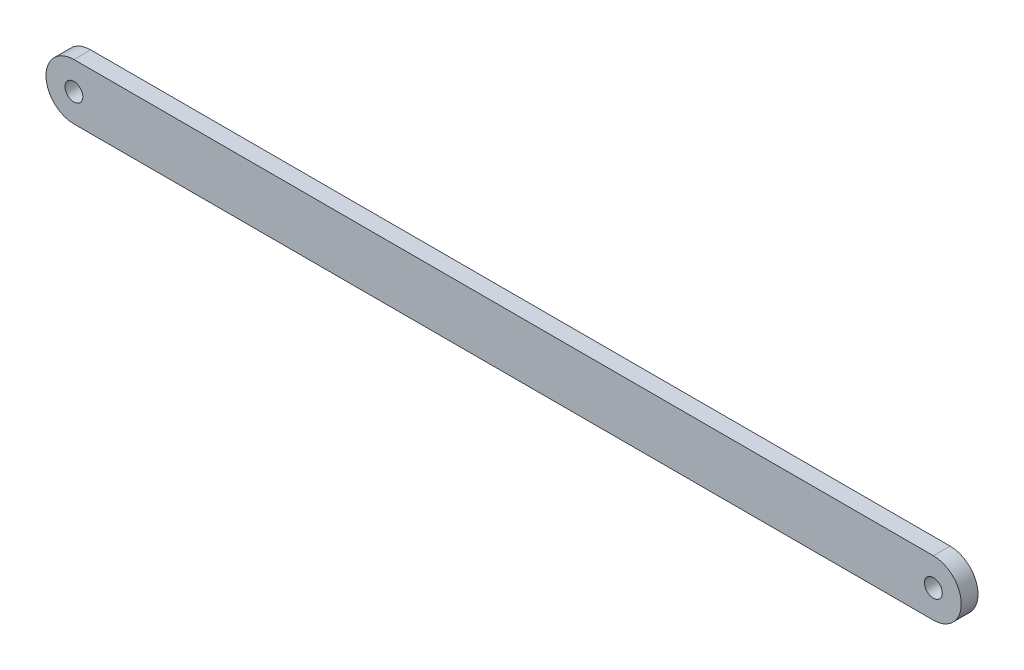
SolidWorks part; units mm, degrees
ref_plane "Plan de face" through (0, 0, 0) normal (0, 0, 1) x (1, 0, 0)
ref_plane "Plan de dessus" through (0, 0, 0) normal (0, 1, 0) x (1, 0, 0)
ref_plane "Plan de droite" through (0, 0, 0) normal (1, 0, 0) x (0, 0, -1)
sketch "Esquisse1" plane through (0, 0, 0) normal (0, 0, 1) x (1, 0, 0)
  line L0 (182.2501, 0) -> (-164.2748, 0) construction
  line L1 (0, -20.5495) -> (0, 63.7295) construction
  line L2 (-140, -20.5495) -> (-140, 96.894) construction
  line L3 (-175.6383, -10) -> (167.9637, -10) construction
  line L4 (-175.6383, 10) -> (167.9637, 10) construction
  line L5 (180, -20.5495) -> (180, 96.894) construction
  line L6 (182.2501, 26) -> (7.9433, 26) construction
  line L7 (0, 0) -> (53.7129, 53.7129) construction
  line L8 (-17.9797, -10.9086) -> (38.7722, 45.8432) construction
  line L9 (-6.3871, -13.4582) -> (53.2982, 46.2271) construction
  line L10 (23, -20.5495) -> (23, 12.6403) construction
  line L11 (4.0635, 21) -> (167.9637, 21) construction
  line L12 (4.0635, 31) -> (167.9637, 31) construction
  line L13 (26, 17.0537) -> (26, 40.2024) construction
  line L14 (26, 31) -> (180, 31)
  line L15 (26, 21) -> (180, 21)
  circle A0 centre (23, 0) radius 10 construction
  circle A1 centre (26, 26) radius 5 construction
  arc A2 (180, 21) -> (180, 31) centre (180, 26) ccw
  circle A3 centre (180, 26) radius 1.6
  circle A4 centre (26, 26) radius 1.6
  arc A6 (26, 31) -> (26, 21) centre (26, 26) ccw
  dimension "D1" = 140
  dimension "D2" = 10
  dimension "D3" = 20
  dimension "D4" = 320
  dimension "D5" = 26
  dimension "D6" = 135
  dimension "D7" = 5
  dimension "D8" = 5
  dimension "D9" = 10
  dimension "D10" = 5
  dimension "D11" = 23
extrude "Boss.-Extru.1" add sketch "Esquisse1" along normal blind 3
